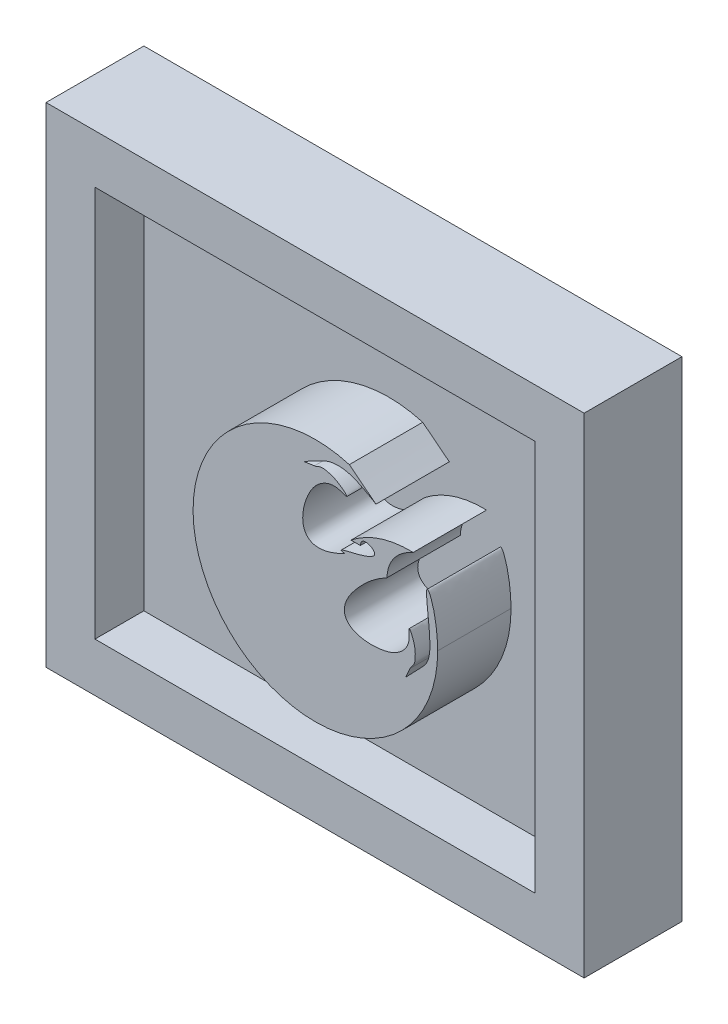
SolidWorks part; units mm, degrees
ref_plane "Front Plane" through (0, 0, 0) normal (0, 0, 1) x (1, 0, 0)
ref_plane "Top Plane" through (0, 0, 0) normal (0, 1, 0) x (1, 0, 0)
ref_plane "Right Plane" through (0, 0, 0) normal (1, 0, 0) x (0, 0, -1)
sketch "Sketch1" plane through (0, 0, 0) normal (0, 0, 1) x (1, 0, 0)
  line L0 (-55, -50) -> (55, -50)
  line L1 (-55, -50) -> (-55, 50)
  line L2 (-55, 50) -> (55, 50)
  line L3 (55, -50) -> (55, 50)
  line L4 (-55, -50) -> (55, 50) construction
  line L5 (-55, 50) -> (55, -50) construction
  point P0 (0, 0)
  dimension "D1" = 110
  dimension "D2" = 50
extrude "Boss-Extrude1" add sketch "Sketch1" along normal blind 20
shell "Shell1" thickness 10
sketch "Sketch2" plane through (0, 0, 10) normal (0, 0, 1) x (1, 0, 0)
  line L0 (12.3456, 8.6929) -> (14.2606, 8.6929)
  line L7 (26.67, -6.7175) -> (23.4716, -10.0427)
  line L8 (6.6999, 19.9093) -> (2.6122, 17.77)
  line L9 (2.6122, 17.77) -> (5.0579, 18.1396)
  line L10 (23.4716, -10.0427) -> (24.5113, -7.7982)
  arc A0 (12.0015, 21.892) -> (30.0578, -2.0508) centre (5.0579, -2.1243) ccw
  spline S0 degree 3 poles (12.0015, 21.892) (21.9411, 13.8888) (13.6106, 21.696) (7.8128, 20.4632) (6.6999, 19.9093) knots 0 0 0 0 0.174434 0.248801 0.248801 0.248801 0.248801
  spline S1 degree 3 poles (30.0578, -2.0508) (30.0569, -1.7287) (29.9142, 4.4376) (26.4804, 12.4967) (29.4613, -4.0733) (27.5133, -5.8042) (26.67, -6.7175) knots 0 0 0 0 0.004404 0.088087 0.174434 0.248801 0.248801 0.248801 0.248801
  spline S2 degree 2 poles (25.0579, 12.8757) (17.8057, 13.0296) (12.3456, 8.6929) knots 0 0 0 1 1 1
  spline S3 degree 3 poles (14.2606, 8.6929) (14.3675, 10.7873) (22.3909, 7.3892) (7.5324, 6.0281) (11.1135, 5.6955) knots 0 0 0 0 0.343546 1 1 1 1
  spline S4 degree 2 poles (25.0579, 12.8757) (19.9294, 10.5235) (19.6828, 5.6955) knots 0 0 0 1 1 1
  spline S5 degree 2 poles (19.6828, 5.6955) (16.613, 4.073) (14.2606, 1.4995) knots 0 0 0 1 1 1
  spline S6 degree 3 poles (4.8713, 18.1114) (4.9343, 18.1168) (5.3528, 18.1802) (6.1944, 18.7239) (7.7551, 18.397) (9.817, 17.6944) (12.284, 15.5596) (10.7171, 16.2107) (8.6758, 16.7695) (5.7439, 15.8266) (1.3671, 9.7836) (1.6372, 0.8401) (11.1135, 5.6955) knots 0.337694 0.337694 0.337694 0.337694 0.341426 0.362746 0.394757 0.429544 0.500579 0.540544 0.562561 0.621531 0.710491 1 1 1 1
  spline S7 degree 3 poles (24.432, -7.9695) (24.4548, -7.9105) (24.6328, -7.5265) (25.3905, -6.8708) (25.5136, -5.281) (25.4164, -3.1048) (24.0578, -0.1388) (24.2441, -1.8254) (24.209, -3.9414) (22.4828, -6.4921) (15.4561, -9.0017) (6.946, -6.2382) (14.2606, 1.4995) knots 0.337694 0.337694 0.337694 0.337694 0.341426 0.362746 0.394757 0.429544 0.500579 0.540544 0.562561 0.621531 0.710491 1 1 1 1
extrude "Boss-Extrude2" add sketch "Sketch2" along normal blind 15 separate body contours L10 S7 S5 S4 S2 L0 S3 S6 L9 L8 S0 A0 S1 L7
